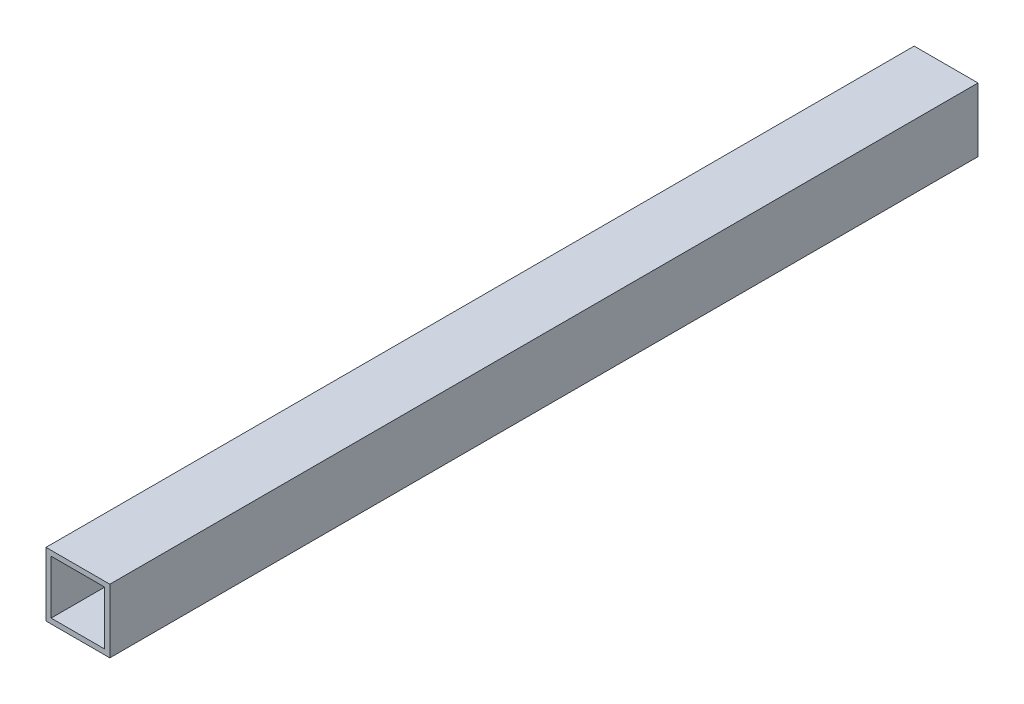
SolidWorks part; units mm, degrees
ref_plane "Plan de face" through (0, 0, 0) normal (0, 0, 1) x (1, 0, 0)
ref_plane "Plan de dessus" through (0, 0, 0) normal (0, 1, 0) x (1, 0, 0)
ref_plane "Plan de droite" through (0, 0, 0) normal (1, 0, 0) x (0, 0, -1)
sketch "Esquisse1" plane through (0, 0, 0) normal (0, 0, 1) x (1, 0, 0)
  line L1 (0, 0) -> (25, 0)
  line L2 (0, 0) -> (0, 25)
  line L3 (0, 25) -> (25, 25)
  line L4 (25, 0) -> (25, 25)
  dimension "D1" = 25
  dimension "D2" = 25
extrude "Boss.-Extru.1" add sketch "Esquisse1" along normal blind 340
sketch "Esquisse2" plane through (0, 0, 340) normal (0, 0, 1) x (1, 0, 0)
  line L0 (0, 25) -> (0, 0) construction
  line L1 (2, 2) -> (23, 2)
  line L2 (2, 2) -> (2, 23)
  line L3 (2, 23) -> (23, 23)
  line L4 (23, 2) -> (23, 23)
  line L5 (0, 0) -> (25, 0) construction
  line L6 (25, 25) -> (0, 25) construction
  line L7 (25, 0) -> (25, 25) construction
  point P8 (12.5, 23)
  dimension "D1" = 2
  dimension "D2" = 2
  dimension "D3" = 2
  dimension "D4" = 2
extrude "Enlèv. mat.-Extru.1" cut sketch "Esquisse2" against normal through all
